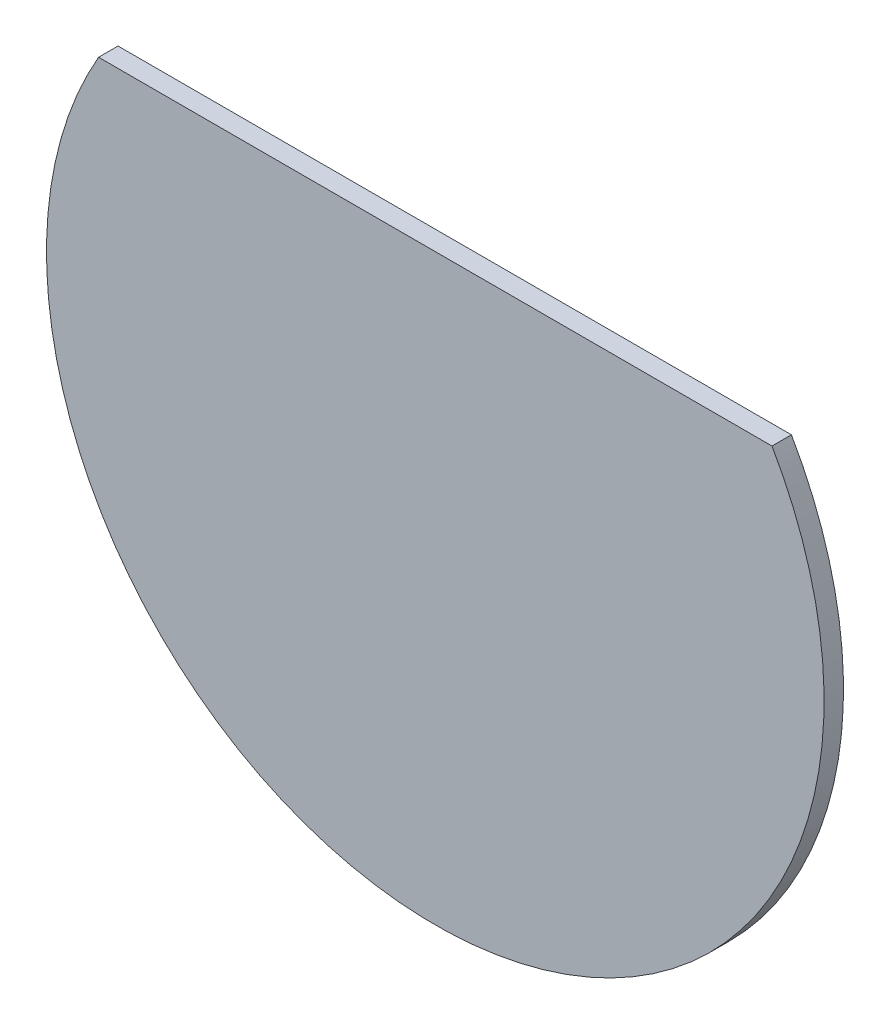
SolidWorks part; units mm, degrees
ref_plane "Front Plane" through (0, 0, 0) normal (0, 0, 1) x (1, 0, 0)
ref_plane "Top Plane" through (0, 0, 0) normal (0, 1, 0) x (1, 0, 0)
ref_plane "Right Plane" through (0, 0, 0) normal (1, 0, 0) x (0, 0, -1)
sketch "Sketch1" plane through (0, 0, 0) normal (0, 0, 1) x (1, 0, 0)
  line L0 (-109.9852, 63.5) -> (109.9852, 63.5)
  arc A0 (-109.9852, 63.5) -> (109.9852, 63.5) centre (0, 0) ccw
  dimension "D2" = 127
  dimension "D1" = 63.5
extrude "Boss-Extrude1" add sketch "Sketch1" along normal blind 6.35
